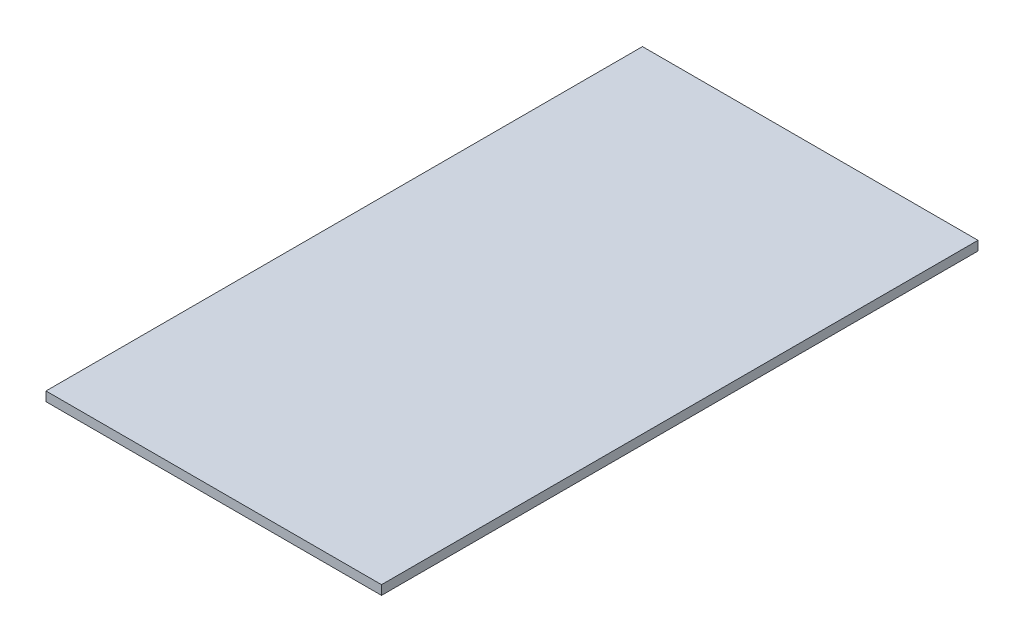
SolidWorks part; units mm, degrees
ref_plane "Front Plane" through (0, 0, 0) normal (0, 0, 1) x (1, 0, 0)
ref_plane "Top Plane" through (0, 0, 0) normal (0, 1, 0) x (1, 0, 0)
ref_plane "Right Plane" through (0, 0, 0) normal (1, 0, 0) x (0, 0, -1)
sketch "Sketch1" plane through (0, 0, 0) normal (0, 1, 0) x (1, 0, 0)
  line L1 (0, 0) -> (685.8, 0)
  line L2 (0, 0) -> (0, 1219.2)
  line L3 (0, 1219.2) -> (685.8, 1219.2)
  line L4 (685.8, 0) -> (685.8, 1219.2)
  dimension "D1" = 1219.2
  dimension "D2" = 685.8
extrude "Extrude1" add sketch "Sketch1" along normal blind 19.05
